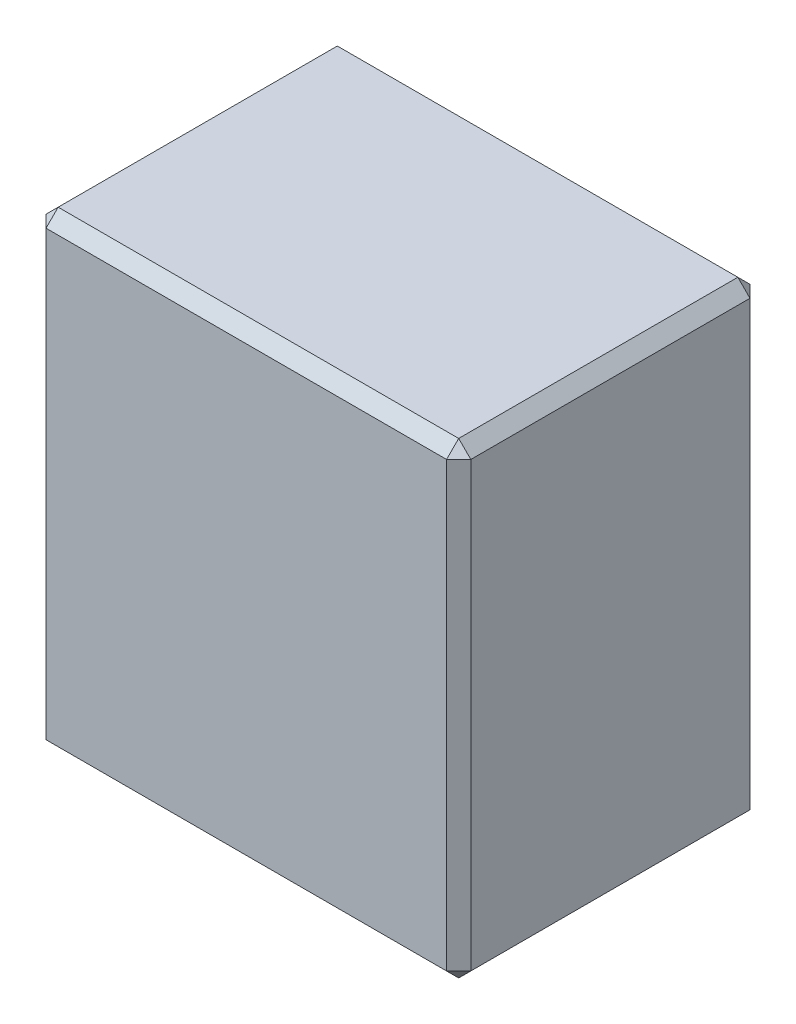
SolidWorks part; units mm, degrees
ref_plane "Plan de face" through (0, 0, 0) normal (0, 0, 1) x (1, 0, 0)
ref_plane "Plan de dessus" through (0, 0, 0) normal (0, 1, 0) x (1, 0, 0)
ref_plane "Plan de droite" through (0, 0, 0) normal (1, 0, 0) x (0, 0, -1)
sketch "Esquisse1" plane through (0, 0, 0) normal (0, 1, 0) x (1, 0, 0)
  line L1 (0, 0) -> (3.5, 0)
  line L2 (0, 0) -> (0, 2.5)
  line L3 (0, 2.5) -> (3.5, 2.5)
  line L4 (3.5, 0) -> (3.5, 2.5)
  dimension "D1" = 2.5
  dimension "D2" = 3.5
extrude "Extrusion1" add sketch "Esquisse1" along normal blind 3.85
chamfer "Chanfrein1" distance 0.1 angle 45 12 edges at (3.5, 1.925, -2.5) (1.75, 3.85, -2.5) (0, 1.925, -2.5) (1.75, 0, -2.5) (0, 1.925, 0) (0, 3.85, -1.25) (1.75, 3.85, 0) (0, 0, -1.25) (1.75, 0, 0) (3.5, 0, -1.25) (3.5, 1.925, 0) (3.5, 3.85, -1.25)
